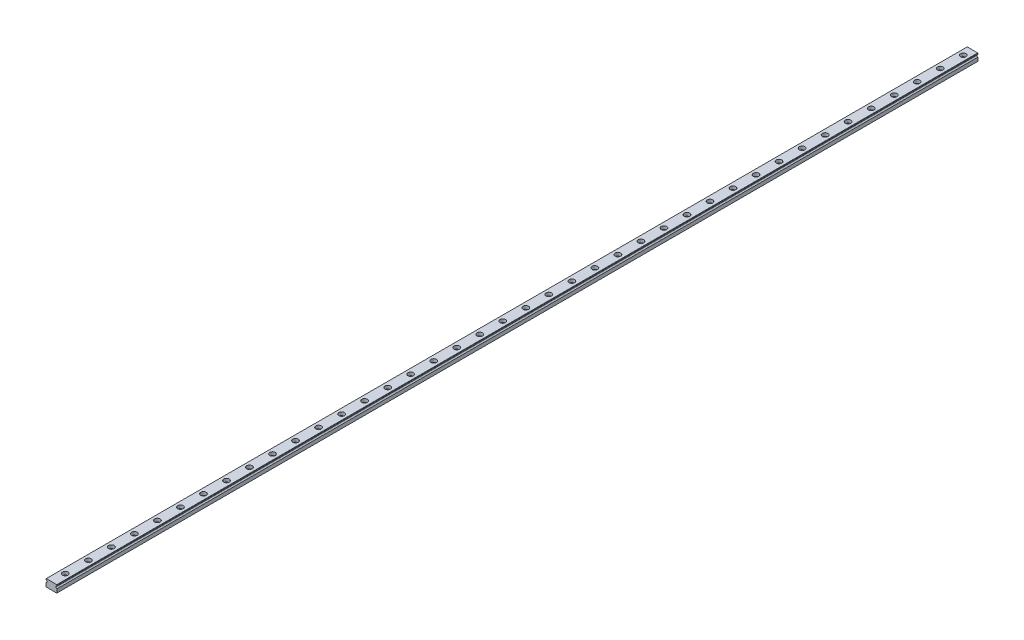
SolidWorks part; units mm, degrees
ref_plane "Front Plane" through (0, 0, 0) normal (0, 0, 1) x (1, 0, 0)
ref_plane "Top Plane" through (0, 0, 0) normal (0, 1, 0) x (1, 0, 0)
ref_plane "Right Plane" through (0, 0, 0) normal (1, 0, 0) x (0, 0, -1)
sketch "Sketch2" plane through (0, 0, 0) normal (0, 0, 1) x (1, 0, 0)
  line L0 (-5.4394, 0.7172) -> (-5.4394, -3.2328)
  line L1 (-5.4394, -3.2328) -> (-5.1394, -3.5328)
  line L2 (-5.1394, -3.5328) -> (1.7606, -3.5328)
  line L3 (2.3606, -3.5328) -> (6.2606, -3.5328)
  line L4 (6.2606, -3.5328) -> (6.5606, -3.2328)
  line L5 (6.5606, -3.2328) -> (6.5606, 0.7172)
  line L6 (6.5606, 3.2172) -> (6.5606, 4.1672)
  line L7 (6.5606, 4.1672) -> (6.2606, 4.4672)
  line L8 (6.2606, 4.4672) -> (-5.1394, 4.4672)
  line L9 (-5.1394, 4.4672) -> (-5.4394, 4.1672)
  line L10 (-5.4394, 4.1672) -> (-5.4394, 3.2172)
  line L11 (1.7606, -3.5328) -> (2.3606, -3.5328)
  arc A1 (5.3106, 1.9672) -> (6.5606, 0.7172) centre (6.5606, 1.9672) ccw
  arc A2 (6.5606, 3.2172) -> (5.3106, 1.9672) centre (6.5606, 1.9672) ccw
  arc A3 (-5.4394, 0.7172) -> (-5.4394, 3.2172) centre (-5.4394, 1.9672) ccw
extrude "Boss-Extrude1" add sketch "Sketch2" along normal blind 1000
sketch "Sketch3" plane through (0, 4.4672, 0) normal (0, 1, 0) x (1, 0, 0)
  line L0 (6.5606, -1000) -> (6.5606, 0) construction
  line L2 (6.2606, 0) -> (-5.1394, 0) construction
  point P0 (0.5606, -10)
  dimension "D1" = 6
  dimension "D2" = 10
hole_wizard "CBORE for M16 Hex Head Bolt1" positions "Sketch3" profile "Sketch4" counterbore size "M16" standard "DIN"
sketch "Sketch4" plane through (0.5606, 4.4672, 10) normal (1, 0, 0) x (0, 0, 1)
  line L0 (0, 0) -> (0, 8)
  line L1 (0, 8) -> (1.75, 8)
  line L3 (1.75, 8) -> (1.75, 3.5)
  line L4 (1.75, 3.5) -> (3, 3.5)
  line L5 (3, 3.5) -> (3, 0)
  line L7 (3, 0) -> (0, 0)
  line L11 (0, -6.35) -> (0, 107.95) construction
  dimension "Thru Hole Dia." = 3.5
  dimension "Thru Hole Depth" = 8
  dimension "C'Bore Dia." = 6
  dimension "C'Bore Depth" = 3.5
other "Fill Pattern1" parameters "D5"=0, "D6"=0, "D1"=25, "D2"=60, "D3"=0, "D9"=40, "D7"=40, "D8"=2
